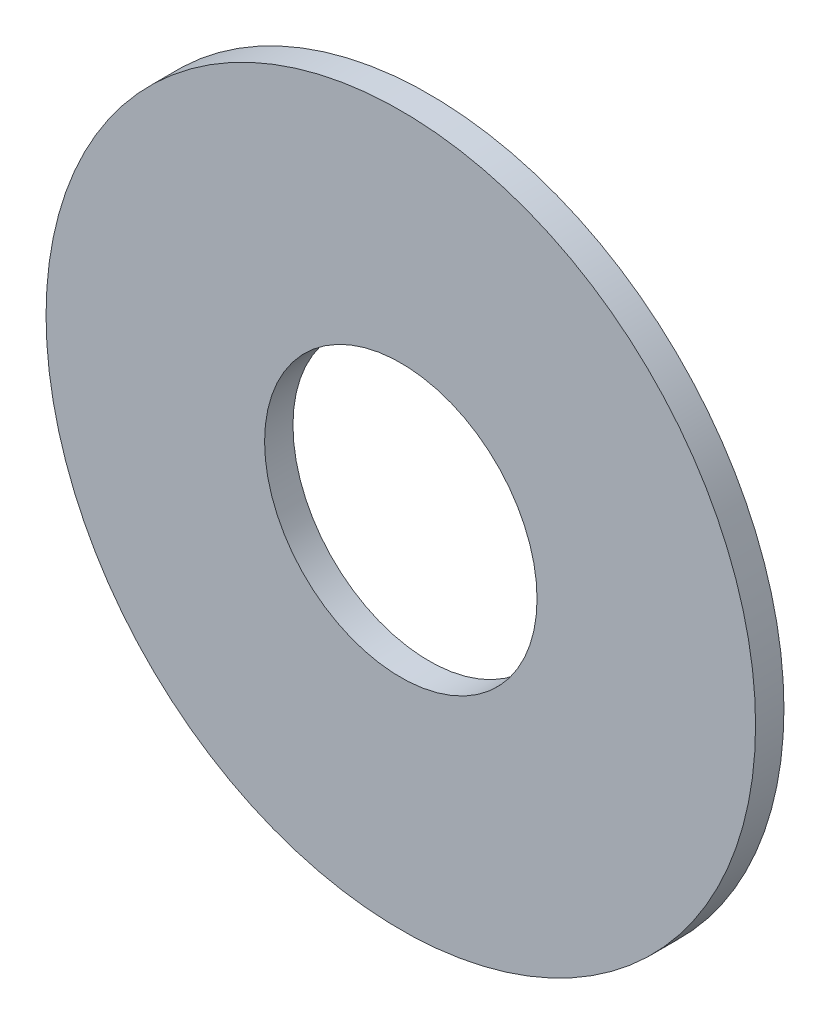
SolidWorks part; units mm, degrees
ref_plane "Plane1" through (0, 0, 0) normal (0, 0, 1) x (1, 0, 0)
ref_plane "Plane2" through (0, 0, 0) normal (0, 1, 0) x (1, 0, 0)
ref_plane "Plane3" through (0, 0, 0) normal (1, 0, 0) x (0, 0, -1)
sketch "Sketch1" plane through (0, 0, 0) normal (0, 0, 1) x (1, 0, 0)
  circle A0 centre (0, 0) radius 6.25
  circle A1 centre (0, 0) radius 2.4
  dimension "D1" = 4.8
  dimension "D2" = 12.5
extrude "shaft washers" add sketch "Sketch1" along normal blind 0.5
equation "\"result\"= 0.000420"
equation "\"result\"= 2*1.060000"
equation "\"result\"= 2.000000*1.060000"
